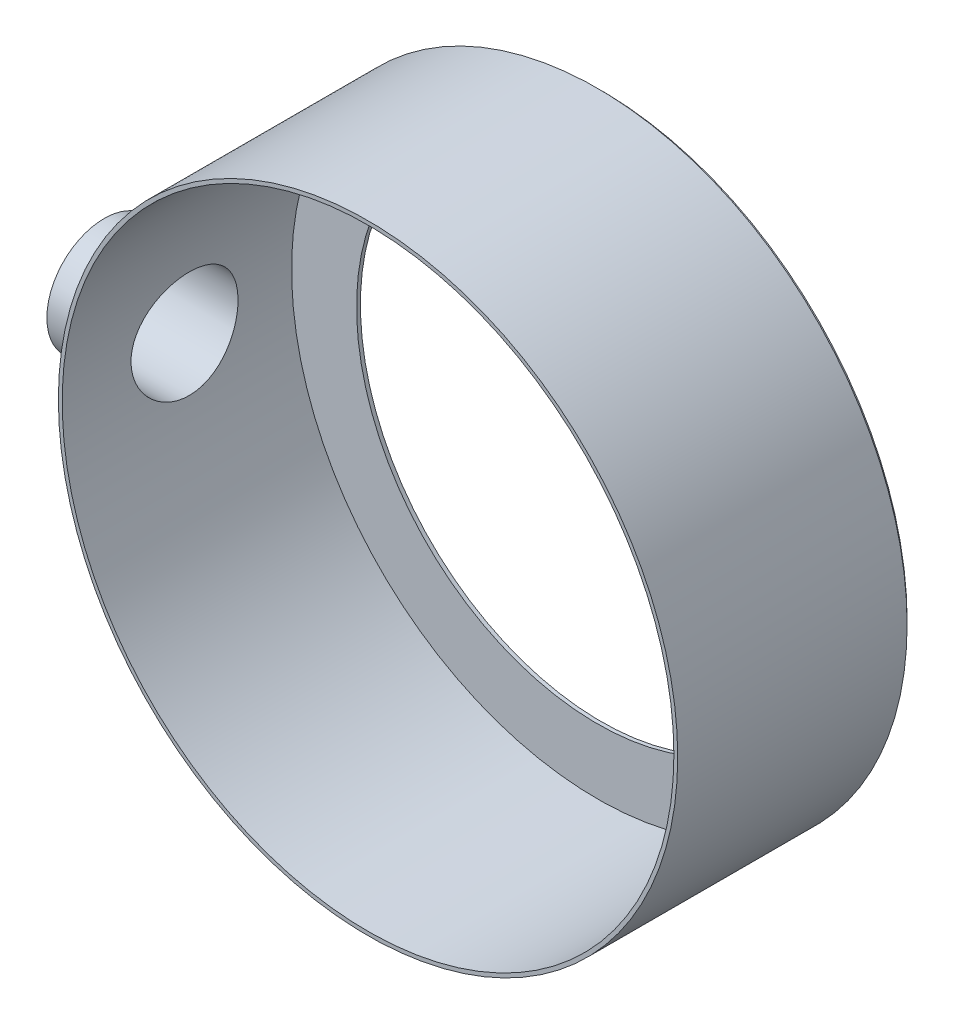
SolidWorks part; units mm, degrees
ref_plane "前视基准面" through (0, 0, 0) normal (0, 0, 1) x (1, 0, 0)
ref_plane "上视基准面" through (0, 0, 0) normal (0, 1, 0) x (1, 0, 0)
ref_plane "右视基准面" through (0, 0, 0) normal (1, 0, 0) x (0, 0, -1)
sketch "草图1" plane through (0, 0, 0) normal (0, 0, 1) x (1, 0, 0)
  circle A0 centre (0, 0) radius 31.5
  circle A1 centre (0, 0) radius 40
  dimension "D1" = 63
  dimension "D2" = 80
extrude "凸台-拉伸1" add sketch "草图1" along normal blind 0.5
sketch "草图2" plane through (0, 0, 0.5) normal (0, 0, 1) x (1, 0, 0)
  circle A0 centre (0, 0) radius 40
  circle A1 centre (0, 0) radius 40.5
  dimension "D1" = 80
  dimension "D2" = 81
extrude "凸台-拉伸2" add sketch "草图2" along normal blind 30 separate body
sketch "草图3" plane through (0, 0, 0) normal (1, 0, 0) x (0, 0, -1)
  line L0 (-0.5, 31.5) -> (-0.5, -31.5) construction
  circle A0 centre (-14.5, 0) radius 7
  dimension "D1" = 14
  dimension "D2" = 14
extrude "切除-拉伸1" cut sketch "草图3" against normal through all
ref_plane "基准面1" through (-40.5, 0, 0) normal (-1, 0, 0) x (0, 0, 1)
sketch "草图4" plane through (-40.5, 0, 0) normal (-1, 0, 0) x (0, 0, 1)
  circle A0 centre (14.5, 0) radius 7 construction
  circle A1 centre (14.5, 0) radius 7
  circle A2 centre (14.5, 0) radius 7.5
  dimension "D1" = 15
extrude "凸台-拉伸3" add sketch "草图4" along normal blind 10 and the other way up to surface contours A2 A1
